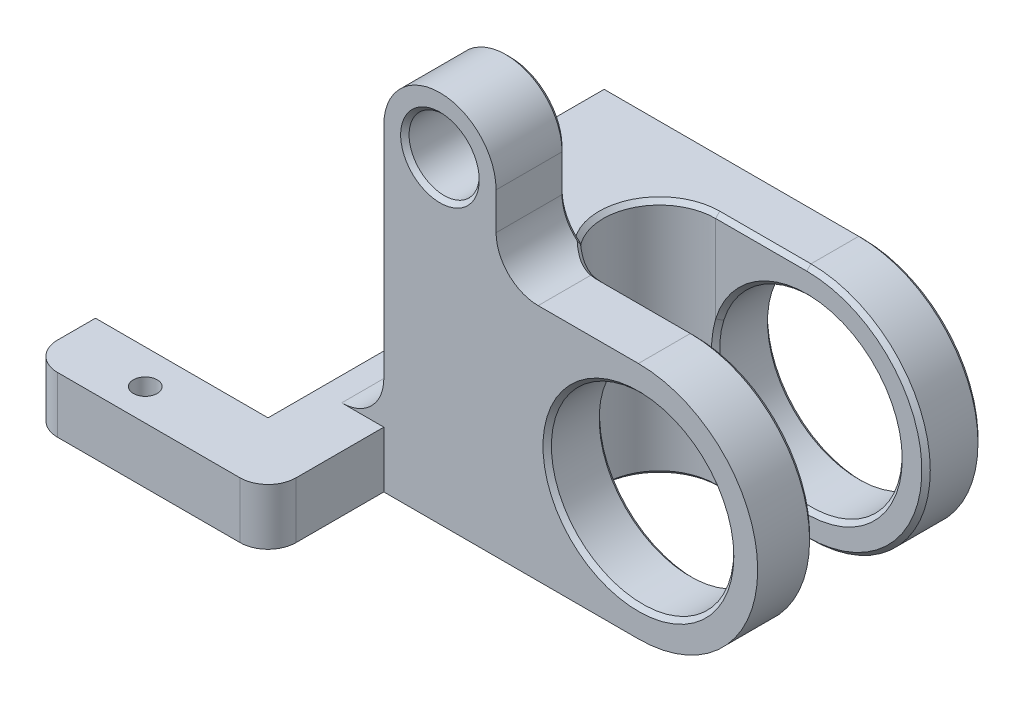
SolidWorks part; units mm, degrees
ref_plane "前视" through (0, 0, 0) normal (0, 0, 1) x (1, 0, 0)
ref_plane "上视" through (0, 0, 0) normal (0, 1, 0) x (1, 0, 0)
ref_plane "右视" through (0, 0, 0) normal (1, 0, 0) x (0, 0, -1)
sketch "草图1" plane through (0, 0, 0) normal (0, 0, 1) x (1, 0, 0)
  line L0 (0, 0) -> (-14.1421, 14.1421) construction
  line L1 (0, 0) -> (-30.8599, 0) construction
  line L2 (-18.1421, 14.1421) -> (-18.1421, -8.5)
  line L3 (-10.1421, 14.1421) -> (-10.1421, 11.5)
  line L4 (-7.1421, 8.5) -> (0, 8.5)
  line L5 (-18.1421, -8.5) -> (0, -8.5)
  circle A0 centre (0, 0) radius 6.5
  circle A1 centre (-14.1421, 14.1421) radius 2.5
  arc A2 (-10.1421, 14.1421) -> (-18.1421, 14.1421) centre (-14.1421, 14.1421) ccw
  arc A3 (0, -8.5) -> (0, 8.5) centre (0, 0) ccw
  arc A4 (-10.1421, 11.5) -> (-7.1421, 8.5) centre (-7.1421, 11.5) ccw
  dimension "D1" = 20
  dimension "D2" = 13
  dimension "D4" = 5
  dimension "D5" = 17
  dimension "D6" = 8
  dimension "D7" = 3
  dimension "D3" = 45
extrude "凸台-拉伸1" add sketch "草图1" along normal mid plane 16
sketch "草图2" plane through (0, 0, 0) normal (1, 0, 0) x (0, 0, -1)
  line L0 (-8, 8.5) -> (8, 8.5) construction
  line L1 (8, 18.1421) -> (-3, 18.1421)
  line L2 (8, 18.1421) -> (8, 8.5)
  line L3 (8, 8.5) -> (-3, 8.5)
  line L4 (-3, 18.1421) -> (-3, 8.5)
  line L5 (-8, 18.1421) -> (-8, 14.1421) construction
  dimension "D1" = 5
extrude "切除-拉伸1" cut sketch "草图2" against normal through all
sketch "草图3" plane through (0, 0, 0) normal (0, 1, 0) x (1, 0, 0)
  line L0 (-19.4333, 0) -> (10.5478, 0) construction
  line L1 (8.5, 0) -> (-6.5, 0) construction
  line L2 (8.5, -8) -> (8.5, 8) construction
  line L3 (8.5, -4) -> (-6.5, -4)
  line L4 (8.5, 4) -> (-6.5, 4)
  arc A0 (8.5, -4) -> (8.5, 4) centre (8.5, 0) ccw
  arc A1 (-6.5, 4) -> (-6.5, -4) centre (-6.5, 0) ccw
  point P7 (1, 0)
  dimension "D1" = 8
  dimension "D2" = 15
extrude "切除-拉伸2" cut sketch "草图3" against normal mid plane 66
sketch "草图4" plane through (0, -8.5, 0) normal (0, -1, 0) x (1, 0, 0)
  line L0 (-18.1421, 8) -> (-18.1421, 16.25)
  line L1 (-18.1421, 16.25) -> (-35.1421, 16.25)
  line L2 (-35.1421, 16.25) -> (-35.1421, 11.25)
  line L3 (-35.1421, 11.25) -> (-23.1421, 11.25)
  line L4 (-23.1421, 11.25) -> (-23.1421, -11.25)
  line L5 (-23.1421, -11.25) -> (-35.1421, -11.25)
  line L6 (-35.1421, -11.25) -> (-35.1421, -16.25)
  line L7 (-35.1421, -16.25) -> (-18.1421, -16.25)
  line L8 (-18.1421, -16.25) -> (-18.1421, 8)
  line L9 (0, 0) -> (-38.7433, 0) construction
  circle A0 centre (-29.1421, 14) radius 0.85
  circle A1 centre (-29.1421, -14) radius 0.85
  dimension "D1" = 28
  dimension "D7" = 1.7
  dimension "D2" = 22.5
  dimension "D3" = 32.5
  dimension "D4" = 12
  dimension "D5" = 5
  dimension "D6" = 6
extrude "凸台-拉伸2" add sketch "草图4" against normal blind 4
chamfer "倒角1" distance 0.3 angle 45 31 edges at (-11.6421, 14.1421, 3) (-3.25, -8.5, -4) (-3.25, -8.5, 4) (-10.5, -8.5, 0) (-11.6421, 14.1421, 8) (6.5, 0, 8) (6.5, 0, -8) (8.5, 0, -4) (-3.25, 8.5, -4) (-10.2417, 8.5, -1.4142) (-6.8221, 8.5, 3.987) (8.5, 0, 4) (-3.25, 8.5, 4) (-9.8817, 10.2775, 3) (-10.1421, 12.8211, 3) (-9.0711, -8.5, -8) (8.5, 0, -8) (-9.0711, 8.5, -8) (-18.1421, 11.3211, 3) (-14.1421, 18.1421, 3) (-8.0297, 8.6343, 3.6959) (-29.1421, -8.5, -11.25) (-29.1421, -4.5, -11.25) (-23.1421, -8.5, 0) (-23.1421, -4.5, 0) (-29.1421, -8.5, 11.25) (-29.1421, -4.5, 11.25) (-6.5, 0, -4) (6.5, 0, 4) (-35.1421, -6.5, 11.25) (-35.1421, -6.5, -11.25)
fillet "圆角2" radius 2 4 edges at (-18.1421, -6.5, -16.25) (-18.1421, -6.5, 16.25) (-35.1421, -6.5, -16.25) (-35.1421, -6.5, 16.25)
fillet "圆角3" radius 3 1 edges at (-18.1421, -4.5, 0)
